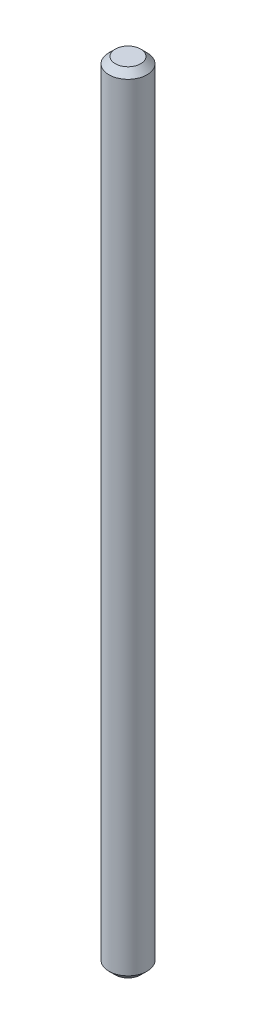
SolidWorks part; units mm, degrees
ref_plane "Front Plane" through (0, 0, 0) normal (0, 0, 1) x (1, 0, 0)
ref_plane "Top Plane" through (0, 0, 0) normal (0, 1, 0) x (1, 0, 0)
ref_plane "Right Plane" through (0, 0, 0) normal (1, 0, 0) x (0, 0, -1)
sketch "Sketch1" plane through (0, 0, 0) normal (0, 1, 0) x (1, 0, 0)
  circle A0 centre (0, 0) radius 1.5
  dimension "D1" = 3
extrude "Boss-Extrude1" add sketch "Sketch1" along normal blind 62
chamfer "Chamfer1" distance 0.5 angle 45 2 edges at (0, 0, 1.5) (0, 62, 1.5)
